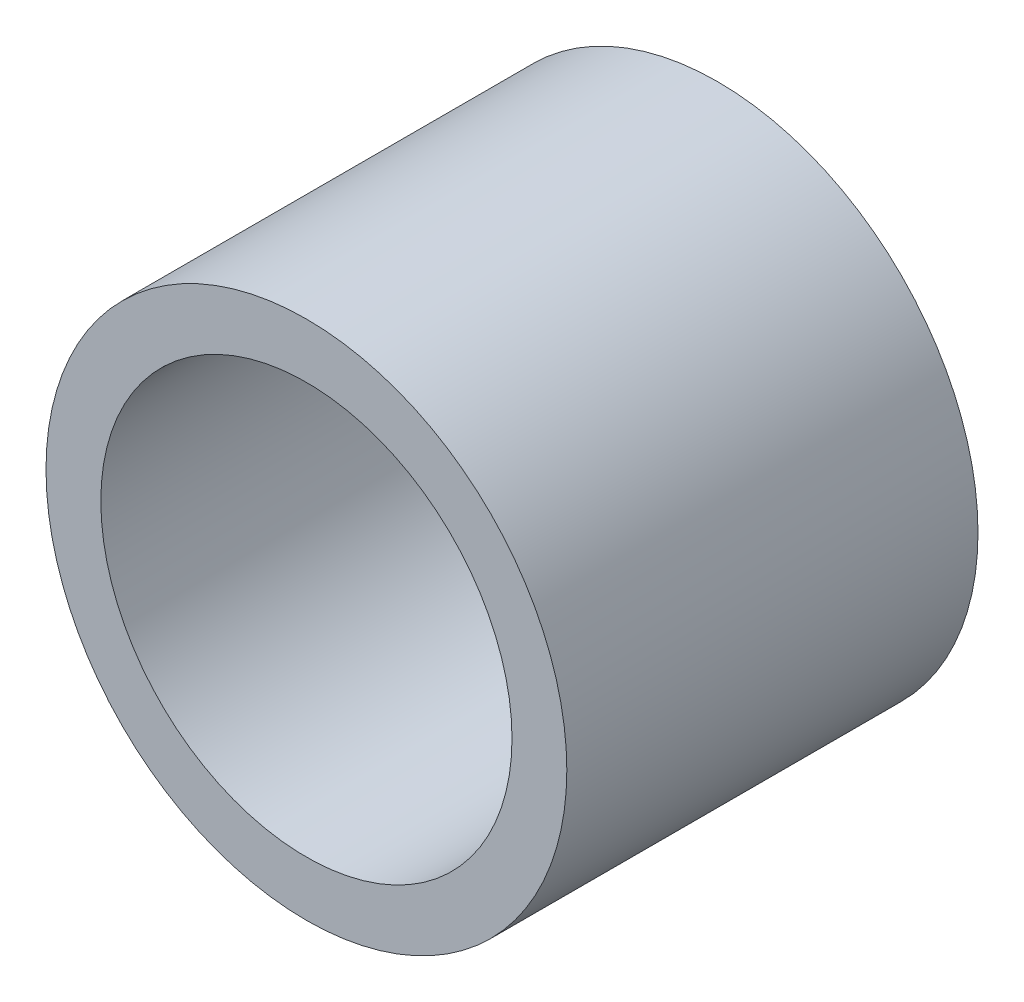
SolidWorks part; units mm, degrees
ref_plane "Plan de face" through (0, 0, 0) normal (0, 0, 1) x (1, 0, 0)
ref_plane "Plan de dessus" through (0, 0, 0) normal (0, 1, 0) x (1, 0, 0)
ref_plane "Plan de droite" through (0, 0, 0) normal (1, 0, 0) x (0, 0, -1)
sketch "Esquisse1" plane through (0, 0, 0) normal (0, 0, 1) x (1, 0, 0)
  circle A0 centre (0, 0) radius 9.5
  circle A1 centre (0, 0) radius 7.5
  dimension "D1" = 19
  dimension "D2" = 15
extrude "Extrusion1" add sketch "Esquisse1" along normal blind 15
